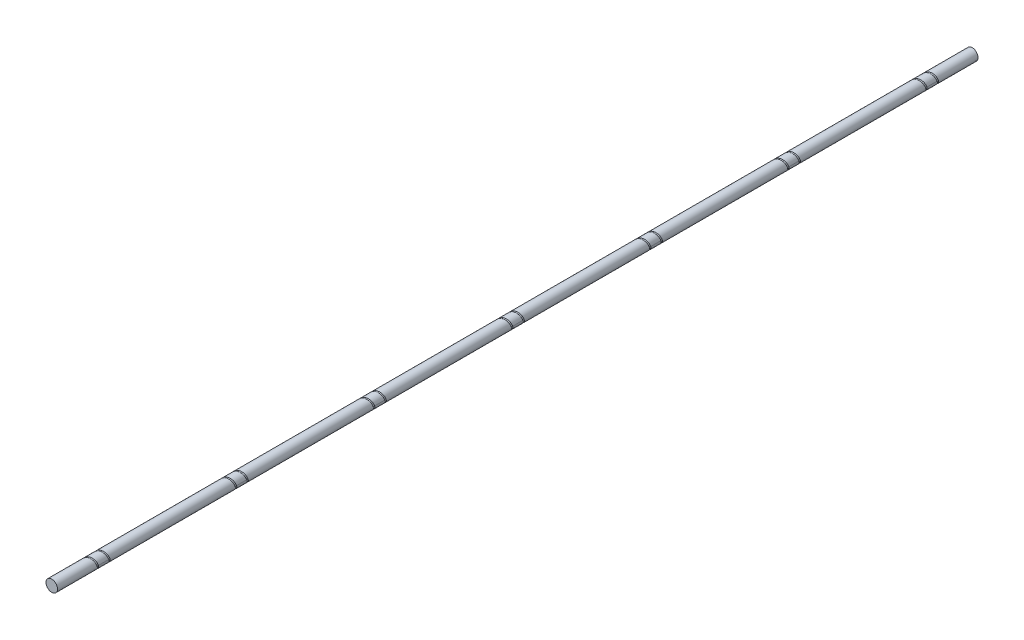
SolidWorks part; units mm, degrees
ref_plane "Front Plane" through (0, 0, 0) normal (0, 0, 1) x (1, 0, 0)
ref_plane "Top Plane" through (0, 0, 0) normal (0, 1, 0) x (1, 0, 0)
ref_plane "Right Plane" through (0, 0, 0) normal (1, 0, 0) x (0, 0, -1)
sketch "Sketch1" plane through (0, 0, 0) normal (0, 0, 1) x (1, 0, 0)
  circle A0 centre (0, 0) radius 25
  dimension "D1" = 50
extrude "Boss-Extrude1" add sketch "Sketch1" along normal blind 4000
ref_plane "Plane1" through (0, 0, 150) normal (0, 0, 1) x (1, 0, 0)
sketch "Sketch2" plane through (0, 0, 150) normal (0, 0, 1) x (1, 0, 0)
  circle A0 centre (0, 0) radius 27.646
  dimension "D1" = 55.292
curve "Helix/Spiral1"
sketch "Sketch3" plane through (0, 0, 0) normal (0, 1, 0) x (1, 0, 0)
  circle A0 centre (-27.646, -150) radius 3.969
  spline S0 degree 3 poles (-27.646, -150) (-27.646, -150.7073) (-26.9833, -152.1286) (-24.0718, -154.2551) (-19.4496, -156.383) (-13.4454, -158.5106) (-6.4857, -160.6383) (0.9349, -162.766) (8.289, -164.8936) (15.0541, -167.0213) (20.7495, -169.1489) (24.9703, -171.2766) (27.4167, -173.4043) (27.9149, -175.5319) (26.4293, -177.6596) (23.0657, -179.7872) (18.063, -181.9149) (11.7766, -184.0426) (4.6535, -186.1702) (-2.8004, -188.2979) (-10.0553, -190.4255) (-16.5956, -192.5532) (-21.9566, -194.6809) (-25.7573, -196.8085) (-27.7277, -198.9362) (-27.7277, -201.0638) (-25.7573, -203.1915) (-21.9566, -205.3191) (-16.5956, -207.4468) (-10.0553, -209.5745) (-2.8004, -211.7021) (4.6535, -213.8298) (11.7766, -215.9574) (18.063, -218.0851) (23.0657, -220.2128) (26.4293, -222.3404) (27.9149, -224.4681) (27.4167, -226.5957) (24.9703, -228.7234) (20.7495, -230.8511) (15.0541, -232.9787) (8.289, -235.1064) (0.9349, -237.234) (-6.4857, -239.3617) (-13.4454, -241.4894) (-19.4496, -243.617) (-24.0718, -245.7449) (-26.9833, -247.8714) (-27.646, -249.2927) (-27.646, -250) knots 0 0 0 0 0.021277 0.042553 0.06383 0.085106 0.106383 0.12766 0.148936 0.170213 0.191489 0.212766 0.234043 0.255319 0.276596 0.297872 0.319149 0.340426 0.361702 0.382979 0.404255 0.425532 0.446809 0.468085 0.489362 0.510638 0.531915 0.553191 0.574468 0.595745 0.617021 0.638298 0.659574 0.680851 0.702128 0.723404 0.744681 0.765957 0.787234 0.808511 0.829787 0.851064 0.87234 0.893617 0.914894 0.93617 0.957447 0.978723 1 1 1 1 construction
  dimension "D1" = 7.938
sweep "Cut-Sweep1" cut profiles "Sketch3" path "Helix/Spiral1"
pattern_linear "LPattern1" count 7 spacing 600 along (0, 0, -1) of "Cut-Sweep1"
